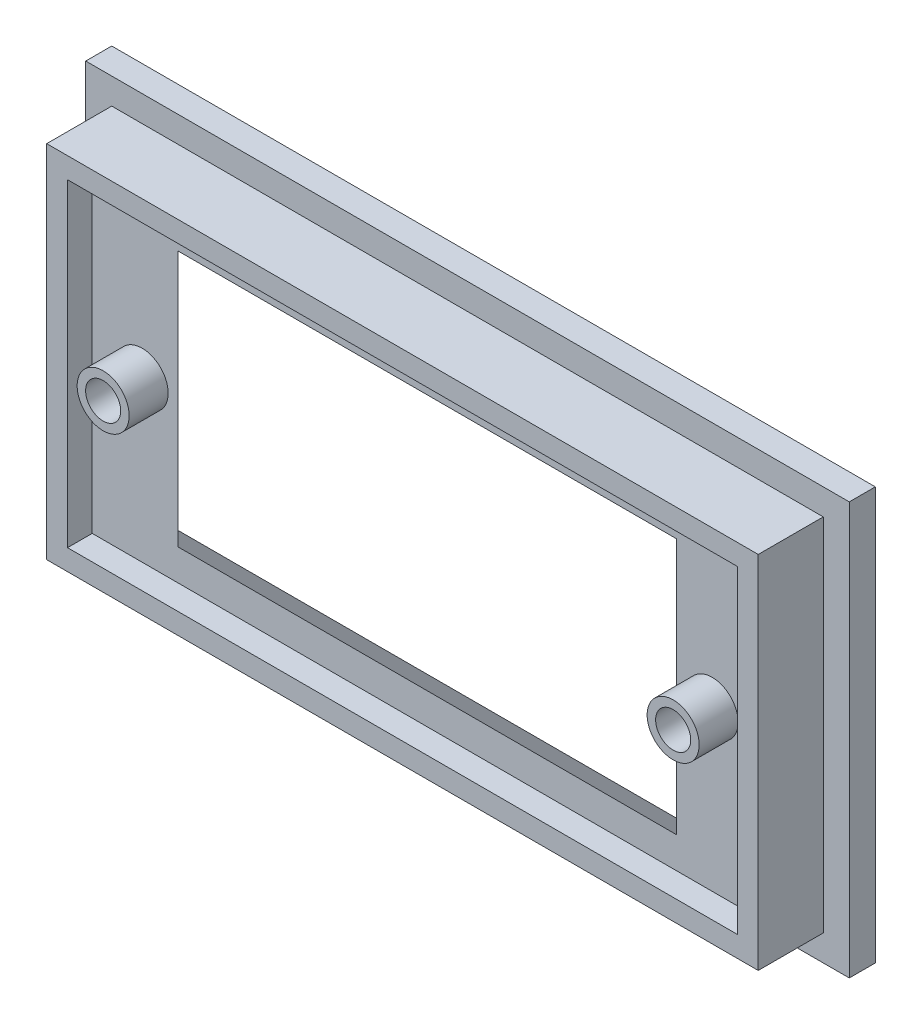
SolidWorks part; units mm, degrees
ref_plane "Přední rovina" through (0, 0, 0) normal (0, 0, 1) x (1, 0, 0)
ref_plane "Horní rovina" through (0, 0, 0) normal (0, 1, 0) x (1, 0, 0)
ref_plane "Pravá rovina" through (0, 0, 0) normal (1, 0, 0) x (0, 0, -1)
sketch "Skica1" plane through (0, 0, 0) normal (0, 0, 1) x (1, 0, 0)
  line L1 (-40.8503, 13.148) -> (17.8497, 13.148)
  line L2 (-40.8503, 13.148) -> (-40.8503, -18.552)
  line L3 (-40.8503, -18.552) -> (17.8497, -18.552)
  line L4 (17.8497, 13.148) -> (17.8497, -18.552)
  dimension "D1" = 58.7
  dimension "D2" = 31.7
extrude "Přidat vysunutím1" add sketch "Skica1" along normal blind 7
sketch "Skica2" plane through (0, 0, 0) normal (0, 0, 1) x (1, 0, 0)
  line L0 (-40.8503, -2.702) -> (18.4787, -2.702) construction
  line L1 (-30.6503, 7.148) -> (7.6497, 7.148)
  line L2 (-30.6503, 7.148) -> (-30.6503, -12.552)
  line L3 (-30.6503, -12.552) -> (7.6497, -12.552)
  line L4 (7.6497, 7.148) -> (7.6497, -12.552)
  line L5 (-40.8503, 13.148) -> (-40.8503, -18.552) construction
  line L6 (-11.5003, 13.148) -> (-11.5003, -18.9842) construction
  line L7 (17.8497, 13.148) -> (-40.8503, 13.148) construction
  line L8 (-30.6503, -2.702) -> (7.6497, -2.702) construction
  line L9 (-11.5003, -12.552) -> (-11.5003, 7.148) construction
  dimension "D1" = 19.7
  dimension "D2" = 38.3
extrude "Odebrat vysunutím1" cut sketch "Skica2" along normal blind 7
sketch "Skica3" [suppressed] plane through (0, 0, 0) normal (0, 0, 1) x (1, 0, 0)
  line L0 (-11.5003, 11.648) -> (-11.5003, -17.052) construction
  line L1 (15.8497, 11.648) -> (-38.8503, 11.648)
  line L2 (15.8497, 11.648) -> (15.8497, -17.052)
  line L3 (15.8497, -17.052) -> (-38.8503, -17.052)
  line L4 (-38.8503, 11.648) -> (-38.8503, -17.052)
  line L5 (15.8497, -2.702) -> (-38.8503, -2.702) construction
  line L6 (17.8497, -2.702) -> (-40.8503, -2.702) construction
  line L7 (17.8497, -18.552) -> (17.8497, 13.148) construction
  line L8 (-40.8503, 13.148) -> (-40.8503, -18.552) construction
  line L9 (-11.5003, 13.148) -> (-11.5003, -18.552) construction
  line L10 (17.8497, 13.148) -> (-40.8503, 13.148) construction
  line L11 (-40.8503, -18.552) -> (17.8497, -18.552) construction
  dimension "D1" = 28.7
  dimension "D2" = 54.7
extrude "Odebrat vysunutím3" [suppressed] cut sketch "Skica3" along normal blind 5 draft 42
sketch "Skica5" plane through (0, 0, 7) normal (0, 0, 1) x (1, 0, 0)
  line L0 (-11.5003, 11.148) -> (-11.5003, -16.552) construction
  line L1 (-38.8503, 11.148) -> (15.8497, 11.148)
  line L2 (-38.8503, 11.148) -> (-38.8503, -16.552)
  line L3 (-38.8503, -16.552) -> (15.8497, -16.552)
  line L4 (15.8497, 11.148) -> (15.8497, -16.552)
  line L5 (-38.8503, -2.702) -> (15.8497, -2.702) construction
  line L6 (-40.8503, -2.702) -> (17.8497, -2.702) construction
  line L7 (-40.8503, 13.148) -> (-40.8503, -18.552) construction
  line L8 (17.8497, -18.552) -> (17.8497, 13.148) construction
  line L9 (-11.5003, 13.148) -> (-11.5003, 11.148) construction
  line L10 (17.8497, 13.148) -> (-40.8503, 13.148) construction
  line L11 (-11.5003, -18.552) -> (-11.5003, 13.148) construction
  line L12 (-40.8503, -18.552) -> (17.8497, -18.552) construction
  dimension "D1" = 27.7
  dimension "D2" = 54.7
extrude "Odebrat vysunutím5" cut sketch "Skica5" against normal blind 5 flip side to cut
sketch "Skica6" plane through (0, 0, 7) normal (0, 0, 1) x (1, 0, 0)
  line L0 (-11.5003, 9.548) -> (-11.5003, -14.952) construction
  line L1 (-37.2503, 9.548) -> (14.2497, 9.548)
  line L2 (-37.2503, 9.548) -> (-37.2503, -14.952)
  line L3 (-37.2503, -14.952) -> (14.2497, -14.952)
  line L4 (14.2497, 9.548) -> (14.2497, -14.952)
  line L5 (-11.5003, 13.148) -> (-11.5003, -18.552) construction
  line L6 (17.8497, 13.148) -> (-40.8503, 13.148) construction
  line L7 (-40.8503, -18.552) -> (17.8497, -18.552) construction
  line L8 (-37.2503, -2.702) -> (14.2497, -2.702) construction
  line L9 (-40.8503, -2.702) -> (17.8497, -2.702) construction
  line L10 (-40.8503, 13.148) -> (-40.8503, -18.552) construction
  line L11 (17.8497, -18.552) -> (17.8497, 13.148) construction
  dimension "D1" = 24.5
  dimension "D2" = 51.5
extrude "Odebrat vysunutím6" cut sketch "Skica6" against normal blind 1.9
sketch "Skica7" plane through (0, 0, 5.1) normal (0, 0, 1) x (1, 0, 0)
  line L0 (-40.8503, -2.702) -> (17.8497, -2.702) construction
  line L1 (-40.8503, 13.148) -> (-40.8503, -18.552) construction
  line L2 (17.8497, -18.552) -> (17.8497, 13.148) construction
  line L5 (-37.2503, 9.548) -> (-37.2503, -14.952) construction
  circle A0 centre (-33.4103, -2.702) radius 2
  circle A1 centre (-33.4103, -2.702) radius 1.35
  dimension "D1" = 3.84
extrude "Přidat vysunutím4" add sketch "Skica7" along normal blind 3
sketch "Skica8" plane through (0, 0, 5.1) normal (0, 0, 1) x (1, 0, 0)
  line L0 (17.8497, -2.702) -> (-40.8503, -2.702) construction
  line L1 (17.8497, -18.552) -> (17.8497, 13.148) construction
  line L2 (-40.8503, 13.148) -> (-40.8503, -18.552) construction
  line L3 (14.2497, -14.952) -> (14.2497, 9.548) construction
  circle A0 centre (10.4097, -2.702) radius 2
  circle A1 centre (10.4097, -2.702) radius 1.35
  dimension "D1" = 3.84
extrude "Přidat vysunutím5" add sketch "Skica8" along normal blind 3
ref_plane "Rovina2" through (17.8497, 13.148, 0) normal (0, 1, 0) x (1, 0, 0)
sketch "Skica12" plane through (0, 0, 0) normal (0, 1, 0) x (1, 0, 0)
  line L0 (-30.6503, -5.1) -> (-38.8503, 0)
  line L1 (-38.8503, 0) -> (15.8497, 0)
  line L2 (15.8497, 0) -> (7.6497, -5.1)
  line L3 (7.6497, -5.1) -> (-30.6503, -5.1)
  line L4 (-40.8503, 0) -> (17.8497, 0) construction
  dimension "D1" = 2
  dimension "D2" = 2
extrude "Odebrat vysunutím7" cut sketch "Skica12" along normal up to surface and the other way up to surface
sketch "Skica13" plane through (0, 0, 0) normal (1, 0, 0) x (0, 0, -1)
  line L0 (0, 11.148) -> (-5.1, 7.148)
  line L1 (-5.1, 7.148) -> (-5.1, -12.552)
  line L2 (-5.1, -12.552) -> (0, -16.552)
  line L3 (0, -16.552) -> (0, 11.148)
  line L4 (0, -18.552) -> (0, 13.148) construction
  dimension "D1" = 2
  dimension "D2" = 2
extrude "Odebrat vysunutím8" cut sketch "Skica13" against normal up to surface and the other way up to surface
